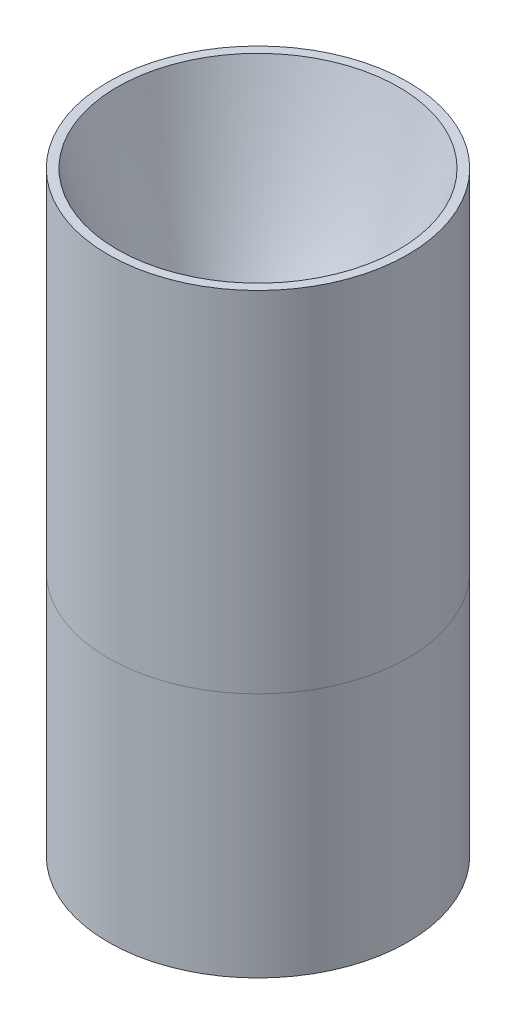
SolidWorks part; units mm, degrees
ref_plane "Front Plane" through (0, 0, 0) normal (0, 0, 1) x (1, 0, 0)
ref_plane "Top Plane" through (0, 0, 0) normal (0, 1, 0) x (1, 0, 0)
ref_plane "Right Plane" through (0, 0, 0) normal (1, 0, 0) x (0, 0, -1)
sketch "Sketch1" plane through (0, 0, 0) normal (0, 0, 1) x (1, 0, 0)
  line L0 (24.01, 0) -> (0, 0) construction
  line L1 (71.6385, 109.9273) -> (76.2, 109.9273)
  line L4 (53.7925, -59.7277) -> (53.7925, -212.1277)
  line L9 (76.2, 109.9273) -> (76.2, -212.1277)
  line L10 (76.2, -212.1277) -> (53.7925, -212.1277)
  line L11 (0, 0) -> (0, -107.6606) construction
  spline S0 degree 2 poles (26.7062, 6.5092) (49.1723, 34.636) (71.6385, 109.9273) knots 0 0 0 1 1 1 construction
  spline S1 degree 2 poles (26.7062, 6.5092) (49.1723, 34.636) (71.6385, 109.9273) knots 0 0 0 1 1 1
  spline S2 degree 4 poles (24.0378, -0.7181) (24.0369, -0.702) (24.0352, -0.674) (24.0319, -0.6548) (24.026, -0.5168) (24.0168, -0.4371) (24.0103, -0.1068) (24.0089, 0.0016) (24.013, 0.2676) (24.0194, 0.4271) (24.0315, 0.6468) (24.0524, 0.9014) (24.0861, 1.2025) (24.1374, 1.5421) (24.2015, 1.881) (24.2781, 2.2164) (24.3673, 2.5492) (24.4687, 2.8781) (24.5826, 3.2033) (24.7081, 3.5236) (24.8462, 3.8397) (24.995, 4.1493) (25.1569, 4.4548) (25.3274, 4.7513) (25.5134, 5.0457) (25.7027, 5.3255) (25.9153, 5.6107) (26.0898, 5.8329) (26.2773, 6.05) (26.4155, 6.2086) (26.6679, 6.4727) (26.7479, 6.5524) (27.0125, 6.8058) (27.099, 6.8781) (27.1963, 6.9666) (27.2147, 6.9802) (27.2373, 7.0002) knots 0 0 0 0 0 0.005192 0.010384 0.020768 0.041536 0.082569 0.102427 0.122284 0.142142 0.162 0.201716 0.241431 0.281147 0.320863 0.360578 0.400294 0.44001 0.479725 0.519441 0.559156 0.598872 0.638588 0.678303 0.718019 0.757735 0.79745 0.837166 0.857024 0.876882 0.916597 0.958047 0.979024 0.989512 1 1 1 1 1 construction
  spline S3 degree 4 poles (24.01, 0) (24.01, 0.0359) (24.0105, 0.1101) (24.013, 0.2676) (24.0194, 0.4271) (24.0315, 0.6468) (24.0524, 0.9014) (24.0861, 1.2025) (24.1374, 1.5421) (24.2015, 1.881) (24.2781, 2.2164) (24.3673, 2.5492) (24.4687, 2.8781) (24.5826, 3.2033) (24.7081, 3.5236) (24.8462, 3.8397) (24.995, 4.1493) (25.1569, 4.4548) (25.3274, 4.7513) (25.5134, 5.0457) (25.7027, 5.3255) (25.9153, 5.6107) (26.0898, 5.8329) (26.2773, 6.05) (26.4155, 6.2086) (26.5814, 6.3821) (26.6555, 6.4585) (26.7062, 6.5092) knots 0.082569 0.082569 0.082569 0.082569 0.082569 0.102427 0.122284 0.142142 0.162 0.201716 0.241431 0.281147 0.320863 0.360578 0.400294 0.44001 0.479725 0.519441 0.559156 0.598872 0.638588 0.678303 0.718019 0.757735 0.79745 0.837166 0.857024 0.876882 0.916597 0.916597 0.916597 0.916597 0.916597
  spline S4 degree 4 poles (24.1192, 2.8078) (24.1123, 2.7164) (24.0991, 2.5516) (24.0751, 2.1752) (24.0462, 1.6879) (24.0258, 1.1016) (24.0139, 0.6554) (24.0097, 0.1102) (24.0097, -0.1001) (24.0129, -0.5432) (24.0192, -0.8242) (24.0287, -1.1948) (24.0414, -1.5134) (24.0572, -1.8619) (24.0761, -2.1937) (24.1038, -2.6181) (24.1432, -3.122) (24.2142, -3.88) (24.3341, -4.8865) (24.5104, -6.0567) (24.7618, -7.3852) (25.0627, -8.7036) (25.4127, -10.0096) (25.8113, -11.3018) (26.2579, -12.5781) (26.7519, -13.8369) (27.2926, -15.0762) (27.8794, -16.2946) (28.5111, -17.4899) (29.1875, -18.6613) (29.9064, -19.8057) (30.669, -20.9239) (31.3701, -21.8744) (31.9997, -22.6734) (32.5351, -23.3204) (32.9832, -23.84) (33.4194, -24.3298) (33.8468, -24.7885) (34.1565, -25.1139) (34.523, -25.486) (34.677, -25.64) (35.0618, -26.0189) (35.3885, -26.3288) (35.8159, -26.7274) (36.1505, -27.0244) (36.4301, -27.2709) (36.5574, -27.38) (36.6257, -27.4388) (36.6605, -27.4687) knots 0 0 0 0 0 0.010393 0.020785 0.041571 0.062104 0.072371 0.082638 0.092575 0.102512 0.112449 0.122387 0.132324 0.142261 0.152198 0.162135 0.18201 0.201884 0.241633 0.281382 0.32113 0.360879 0.400628 0.440377 0.480126 0.519874 0.559623 0.599372 0.639121 0.67887 0.718618 0.758367 0.798116 0.81799 0.837865 0.857739 0.877613 0.897488 0.907425 0.917362 0.927629 0.937896 0.958429 0.979215 0.989607 0.994804 1 1 1 1 1 construction
  spline S5 degree 4 poles (24.01, 0) (24.01, -0.0705) (24.0105, -0.2136) (24.0129, -0.5432) (24.0192, -0.8242) (24.0287, -1.1948) (24.0414, -1.5134) (24.0572, -1.8619) (24.0761, -2.1937) (24.1038, -2.6181) (24.1432, -3.122) (24.2142, -3.88) (24.3341, -4.8865) (24.5104, -6.0567) (24.7618, -7.3852) (25.0627, -8.7036) (25.4127, -10.0096) (25.8113, -11.3018) (26.2579, -12.5781) (26.7519, -13.8369) (27.2926, -15.0762) (27.8794, -16.2946) (28.5111, -17.4899) (29.1875, -18.6613) (29.9064, -19.8057) (30.669, -20.9239) (31.3701, -21.8744) (31.9997, -22.6734) (32.5351, -23.3204) (32.9832, -23.84) (33.4194, -24.3298) (33.8468, -24.7885) (34.1565, -25.1139) (34.4478, -25.4096) (34.5473, -25.5099) (34.5972, -25.5598) knots 0.082638 0.082638 0.082638 0.082638 0.082638 0.092575 0.102512 0.112449 0.122387 0.132324 0.142261 0.152198 0.162135 0.18201 0.201884 0.241633 0.281382 0.32113 0.360879 0.400628 0.440377 0.480126 0.519874 0.559623 0.599372 0.639121 0.67887 0.718618 0.758367 0.798116 0.81799 0.837865 0.857739 0.877613 0.897488 0.907425 0.917362 0.917362 0.917362 0.917362 0.917362
  spline S6 degree 1 poles (34.5972, -25.5598) (43.2048, -34.1675) knots 0 0 1 1 construction
  spline S7 degree 1 poles (34.5972, -25.5598) (43.2048, -34.1675) knots 0 0 1 1
  spline S8 degree 4 poles (53.6833, -62.5354) (53.6902, -62.4466) (53.7033, -62.2738) (53.7213, -62.0018) (53.7419, -61.6601) (53.7589, -61.2922) (53.7725, -60.9659) (53.7826, -60.5754) (53.7894, -60.2941) (53.7927, -59.8333) (53.7927, -59.6305) (53.7896, -59.1817) (53.7832, -58.905) (53.7737, -58.5327) (53.7611, -58.213) (53.7414, -57.7818) (53.7113, -57.2811) (53.6671, -56.6882) (53.5882, -55.8486) (53.4884, -55.0083) (53.3676, -54.1726) (53.1977, -53.1726) (53.003, -52.1776) (52.7773, -51.1887) (52.5209, -50.2076) (52.2402, -49.2332) (51.9353, -48.2661) (51.5445, -47.1493) (51.0505, -45.8906) (50.5097, -44.6511) (49.923, -43.4329) (49.2911, -42.2373) (48.6151, -41.0663) (47.8954, -39.9211) (47.134, -38.8042) (46.4308, -37.8516) (45.8045, -37.0558) (45.2637, -36.4035) (44.8261, -35.8944) (44.4257, -35.4472) (44.0924, -35.0848) (43.7849, -34.7605) (43.585, -34.5517) (43.2762, -34.2384) (43.1268, -34.0891) (42.7386, -33.7068) (42.415, -33.3999) (41.985, -32.9988) (41.6521, -32.7035) (41.3716, -32.4561) (41.2447, -32.3474) (41.1763, -32.2885) (41.1415, -32.2585) knots 0 0 0 0 0 0.010393 0.020785 0.031178 0.041571 0.051838 0.062104 0.072371 0.082638 0.092575 0.102512 0.112449 0.122387 0.132324 0.142261 0.162135 0.18201 0.201884 0.241633 0.261507 0.281382 0.32113 0.360879 0.380754 0.400628 0.440377 0.480126 0.519874 0.559623 0.599372 0.639121 0.67887 0.718618 0.758367 0.798116 0.81799 0.837865 0.857739 0.877613 0.887551 0.897488 0.907425 0.917362 0.927629 0.937896 0.958429 0.979215 0.989607 0.994804 1 1 1 1 1 construction
  spline S9 degree 4 poles (53.7925, -59.7277) (53.7925, -59.6571) (53.7919, -59.5156) (53.7896, -59.1817) (53.7832, -58.905) (53.7737, -58.5327) (53.7611, -58.213) (53.7414, -57.7818) (53.7113, -57.2811) (53.6671, -56.6882) (53.5882, -55.8486) (53.4884, -55.0083) (53.3676, -54.1726) (53.1977, -53.1726) (53.003, -52.1776) (52.7773, -51.1887) (52.5209, -50.2076) (52.2402, -49.2332) (51.9353, -48.2661) (51.5445, -47.1493) (51.0505, -45.8906) (50.5097, -44.6511) (49.923, -43.4329) (49.2911, -42.2373) (48.6151, -41.0663) (47.8954, -39.9211) (47.134, -38.8042) (46.4308, -37.8516) (45.8045, -37.0558) (45.2637, -36.4035) (44.8261, -35.8944) (44.4257, -35.4472) (44.0924, -35.0848) (43.7849, -34.7605) (43.585, -34.5517) (43.3553, -34.3187) (43.2547, -34.2173) (43.2048, -34.1675) knots 0.082638 0.082638 0.082638 0.082638 0.082638 0.092575 0.102512 0.112449 0.122387 0.132324 0.142261 0.162135 0.18201 0.201884 0.241633 0.261507 0.281382 0.32113 0.360879 0.380754 0.400628 0.440377 0.480126 0.519874 0.559623 0.599372 0.639121 0.67887 0.718618 0.758367 0.798116 0.81799 0.837865 0.857739 0.877613 0.887551 0.897488 0.907425 0.917362 0.917362 0.917362 0.917362 0.917362
  spline S10 degree 2 poles (36.8348, 6.4922) (58.5923, 47.8769) (81.7275, 109.9275) knots 0.477621 0.477621 0.477621 0.998065 0.998065 0.998065 construction
  dimension "D1" = 152.4
  dimension "D2" = 24.01
  dimension "D3" = 152.4
revolve "Revolve2" add sketch "Sketch1" angle 360 about L11
other "shorten_chamber_.75in" parameters "D1"=19.05
hole_wizard "3/8-24 Tapped Hole1" positions "Sketch3" profile "Sketch4" tap size "3/8-24" standard "ANSI Inch"
sketch "Sketch3" plane through (0, -193.0777, 0) normal (0, -1, 0) x (-1, 0, 0)
  circle A1 centre (0, 0) radius 66.675 construction
  point P10 (-66.675, 0)
  dimension "D1" = 133.35
sketch "Sketch4" plane through (66.675, -193.0777, 0) normal (1, 0, 0) x (0, 0, -1)
  line L0 (0, 0) -> (0, 27.5347)
  line L1 (0, 27.5347) -> (4.2164, 25.0012)
  line L2 (4.2164, 25.0012) -> (4.2164, 0)
  line L5 (4.2164, 0) -> (0, 0)
  line L10 (0, 27.5347) -> (-4.2164, 25.0012) construction
  line L11 (0, -6.35) -> (0, 107.95) construction
  dimension "Tap Drill Dia." = 8.4328
  dimension "Tap Drill Depth" = 25.0012
  dimension "Drill Angle" = 118
pattern_circular "CirPattern1" count 8 over 360
sketch "Sketch8" [suppressed] plane through (0, -212.1275, 0) normal (0, -1, 0) x (1, 0, 0)
  circle A0 centre (0, 0) radius 53.8815 construction
  circle A1 centre (0, 0) radius 76.49 construction
  circle A2 centre (0, 0) radius 65.2002 construction
  dimension "D1" = 107.7631
  dimension "D2" = 130.4004
  dimension "D3" = 152.98
sketch "Sketch9" [suppressed] plane through (0, -212.1277, 0) normal (0, -1, 0) x (1, 0, 0)
  circle A0 centre (0, 0) radius 53.8815
  circle A1 centre (0, 0) radius 56.8815
  dimension "D1" = 3
extrude "Cut-Extrude1" [suppressed] cut sketch "Sketch9" against normal blind 6
hole_wizard "1/4 (0.2500) Dowel Hole1" positions "Sketch11" profile "Sketch12" hole size "1/4" standard "ANSI Inch"
sketch "Sketch11" [suppressed] plane through (0, -212.1277, 0) normal (0, -1, 0) x (-1, 0, 0)
  line L6 (0, 0) -> (61.5997, -25.5154) construction
  line L8 (0, 0) -> (-61.5997, 25.5154) construction
  line L9 (0, 0) -> (-66.675, 0) construction
  circle A0 centre (0, 0) radius 66.675 construction
  point P22 (61.5997, -25.5154)
  point P28 (-61.5997, 25.5154)
  dimension "D1" = 22.5
sketch "Sketch12" plane through (61.5997, -212.1277, -25.5154) normal (1, 0, 0) x (0, 0, -1)
  line L0 (0, 0) -> (0, 11.829)
  line L1 (0, 11.829) -> (3.2004, 9.906)
  line L2 (3.2004, 9.906) -> (3.2004, 0)
  line L5 (3.2004, 0) -> (0, 0)
  line L10 (0, 11.829) -> (-3.2004, 9.906) construction
  line L11 (0, -6.35) -> (0, 107.95) construction
  dimension "Hole Dia." = 6.4008
  dimension "Hole Depth" = 9.906
  dimension "Drill Angle" = 118
sketch "Sketch14" plane through (0, -193.0777, 0) normal (0, -1, 0) x (1, 0, 0)
  circle A0 centre (0, 0) radius 53.7925 construction
  circle A1 centre (0, 0) radius 53.7925 construction
  circle A2 centre (0, 0) radius 55.38
  circle A3 centre (0, 0) radius 57.412
  dimension "D1" = 1.5875
  dimension "D2" = 2.032
extrude "gasket_groove" [suppressed] cut sketch "Sketch14" against normal blind 1.27
sketch "Sketch15" plane through (0, 0, 0) normal (0, 0, 1) x (1, 0, 0)
  line L0 (-76.2, -67.8727) -> (76.2, -67.8727)
  line L1 (-76.2, 109.9273) -> (-76.2, -193.0777) construction
  line L2 (76.2, -193.0777) -> (76.2, 109.9273) construction
  line L3 (71.6385, 109.9273) -> (-71.6385, 109.9273) construction
  dimension "D1" = 177.8
split "Split1" trim tools "Sketch15" bodies to split 107 resulting bodies 108 109
